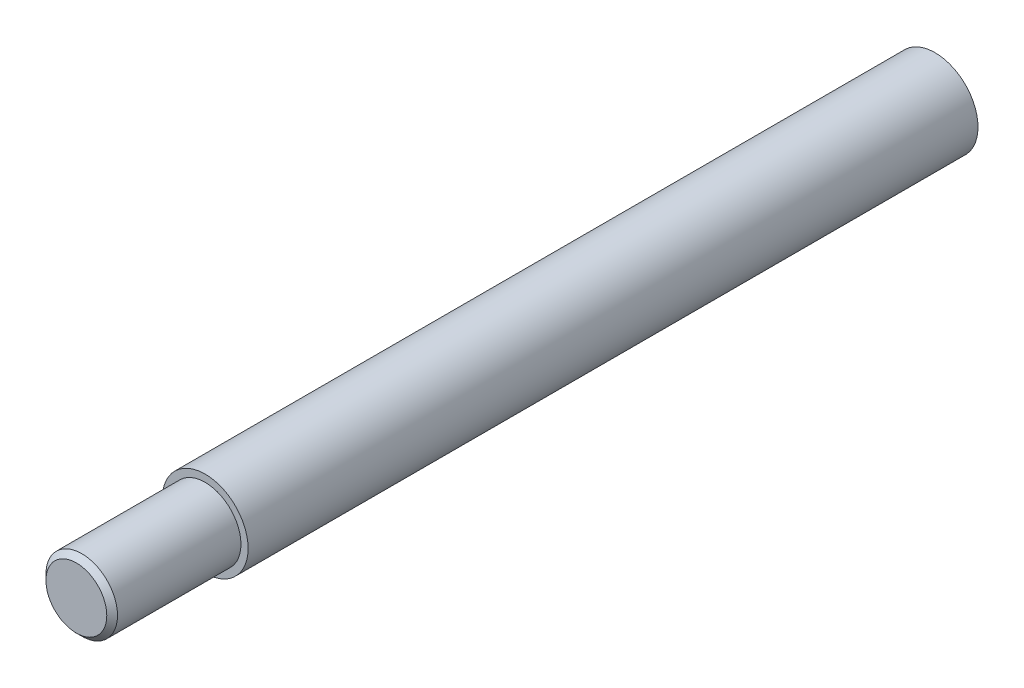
SolidWorks part; units mm, degrees
ref_plane "Plan de face" through (0, 0, 0) normal (0, 0, 1) x (1, 0, 0)
ref_plane "Plan de dessus" through (0, 0, 0) normal (0, 1, 0) x (1, 0, 0)
ref_plane "Plan de droite" through (0, 0, 0) normal (1, 0, 0) x (0, 0, -1)
sketch "Esquisse1" plane through (0, 0, 0) normal (0, 0, 1) x (1, 0, 0)
  circle A0 centre (0, 0) radius 6
  dimension "D1" = 12
extrude "Extrusion1" add sketch "Esquisse1" along normal blind 120
sketch "Esquisse2" plane through (0, 0, 120) normal (0, 0, 1) x (1, 0, 0)
  circle A0 centre (0, 0) radius 5
  circle A1 centre (0, 0) radius 6 construction
  dimension "D1" = 10
extrude "Enlèv. mat.-Extru.1" cut sketch "Esquisse2" against normal blind 18 flip side to cut
chamfer "Chanfrein1" distance 0.75 angle 45 1 edges at (5, 0, 120)
